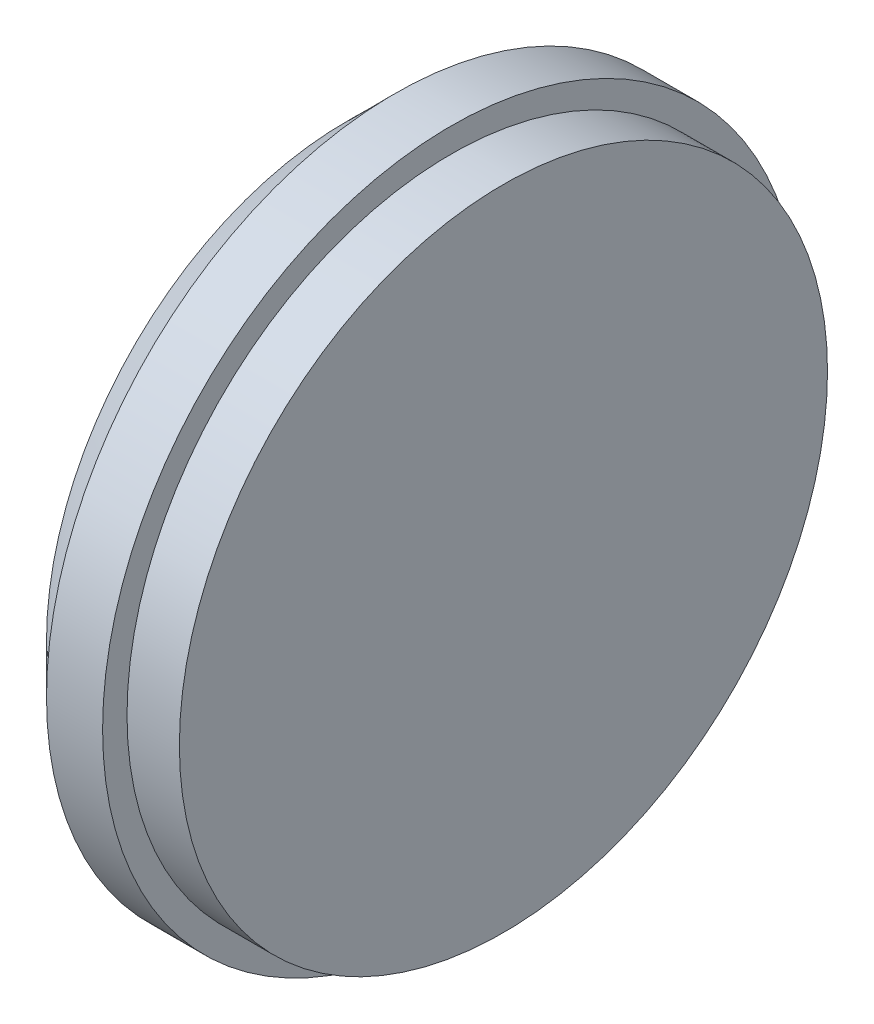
SolidWorks part; units mm, degrees
ref_plane "Front Plane" through (0, 0, 0) normal (0, 0, 1) x (1, 0, 0)
ref_plane "Top Plane" through (0, 0, 0) normal (0, 1, 0) x (1, 0, 0)
ref_plane "Right Plane" through (0, 0, 0) normal (1, 0, 0) x (0, 0, -1)
sketch "Sketch1" plane through (0, 0, 0) normal (0, 0, 1) x (1, 0, 0)
  line L1 (-6.3475, 31.3411) -> (-6.3475, -3.0505)
  line L2 (-6.3475, -3.0505) -> (-11.905, -3.0505)
  line L3 (-11.905, -3.0505) -> (-11.905, -5.6413)
  line L4 (-11.905, -5.6413) -> (-17.8587, -5.6413)
  line L5 (-17.8587, -5.6413) -> (-23.0175, -0.4826)
  line L6 (-23.0175, -0.4826) -> (-23.0175, 31.3411)
  line L7 (-23.0175, 31.3411) -> (-6.3475, 31.3411)
  dimension "D1" = 34.3916
  dimension "D2" = 45
  dimension "D3" = 5.5575
  dimension "D4" = 5.9538
  dimension "D5" = 5.1587
  dimension "D6" = 36.9824
revolve "Revolve1" add sketch "Sketch1" angle 360 about L7
